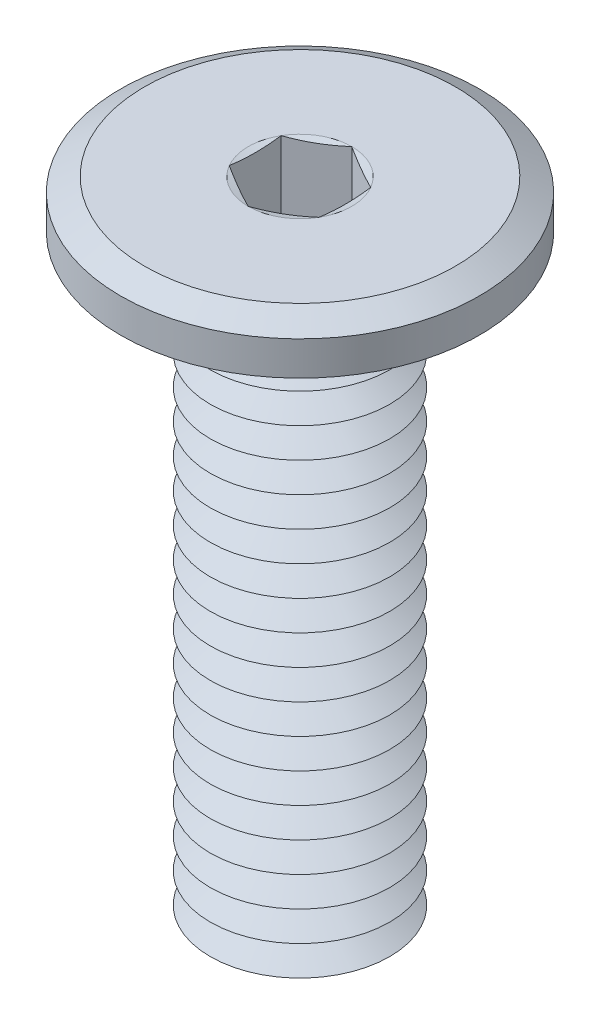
SolidWorks part; units mm, degrees
ref_plane "Front Plane" through (0, 0, 0) normal (0, 0, 1) x (1, 0, 0)
ref_plane "Top Plane" through (0, 0, 0) normal (0, 1, 0) x (1, 0, 0)
ref_plane "Right Plane" through (0, 0, 0) normal (1, 0, 0) x (0, 0, -1)
sketch "Sketch1" plane through (0, 0, 0) normal (0, 1, 0) x (1, 0, 0)
  circle A0 centre (0, 0) radius 3
  dimension "D1" = 6
extrude "Boss-Extrude1" add sketch "Sketch1" against normal blind 0.8
sketch "Sketch2" plane through (0, -0.8, 0) normal (0, -1, 0) x (1, 0, 0)
  circle A0 centre (0, 0) radius 1.5
  dimension "D1" = 3
extrude "Boss-Extrude2" add sketch "Sketch2" along normal blind 10
sketch "Sketch3" plane through (0, 0, 0) normal (1, 0, 0) x (0, 0, -1)
  line L0 (0, 0.9906) -> (0, -8.2999) construction
sketch "Sketch5" plane through (0, 0, 0) normal (1, 0, 0) x (0, 0, -1)
  line L0 (-1.5, -11.05) -> (-1.067, -10.8)
  line L1 (-1.5, -0.8) -> (-1.5, -10.8) construction
  line L2 (-1.067, -10.8) -> (-1.5, -10.55)
  line L3 (-1.5, -0.8) -> (-1.5, -10.8) construction
  line L4 (-1.5, -10.55) -> (-1.5, -11.05)
  line L6 (-1.5, -0.8) -> (-1.5, -10.8) construction
  line L7 (-1.5, -0.8) -> (-1.5, -10.8) construction
  line L14 (-1.5, -10.8) -> (1.5, -10.8) construction
  dimension "D1" = 0.5
revolve "Cut-Revolve1" cut sketch "Sketch5" angle 360 about L0
pattern_linear "LPattern1" count 19 spacing 0.5 along (0, 1, 0) of "Cut-Revolve1"
fillet "Fillet1" radius 0.1 1 edges at (0, -0.8, -1.5)
chamfer "Chamfer2" distance 0.4 angle 30 1 edges at (0, 0, 3)
sketch "Sketch6" plane through (0, 0, 0) normal (0, 1, 0) x (1, 0, 0)
  line L1 (0, 0.866) -> (-0.75, 0.433)
  line L2 (-0.75, 0.433) -> (-0.75, -0.433)
  line L3 (-0.75, -0.433) -> (0, -0.866)
  line L4 (0, -0.866) -> (0.75, -0.433)
  line L5 (0.75, -0.433) -> (0.75, 0.433)
  line L6 (0.75, 0.433) -> (0, 0.866)
  circle A0 centre (0, 0) radius 0.75 construction
  dimension "D1" = 1.5
extrude "Cut-Extrude1" cut sketch "Sketch6" against normal blind 1.4
sketch "Sketch7" plane through (0, -1.4, 0) normal (0, 1, 0) x (1, 0, 0)
  line L0 (-0.75, 0.433) -> (-0.75, -0.433) construction
  circle A0 centre (0, 0) radius 0.75
extrude "Cut-Extrude2" cut sketch "Sketch7" against normal through all draft 60
sketch "Sketch8" plane through (0, 0, 0) normal (0, 1, 0) x (1, 0, 0)
  circle A0 centre (0, 0) radius 0.866
extrude "Cut-Extrude3" cut sketch "Sketch8" against normal through all draft 75
